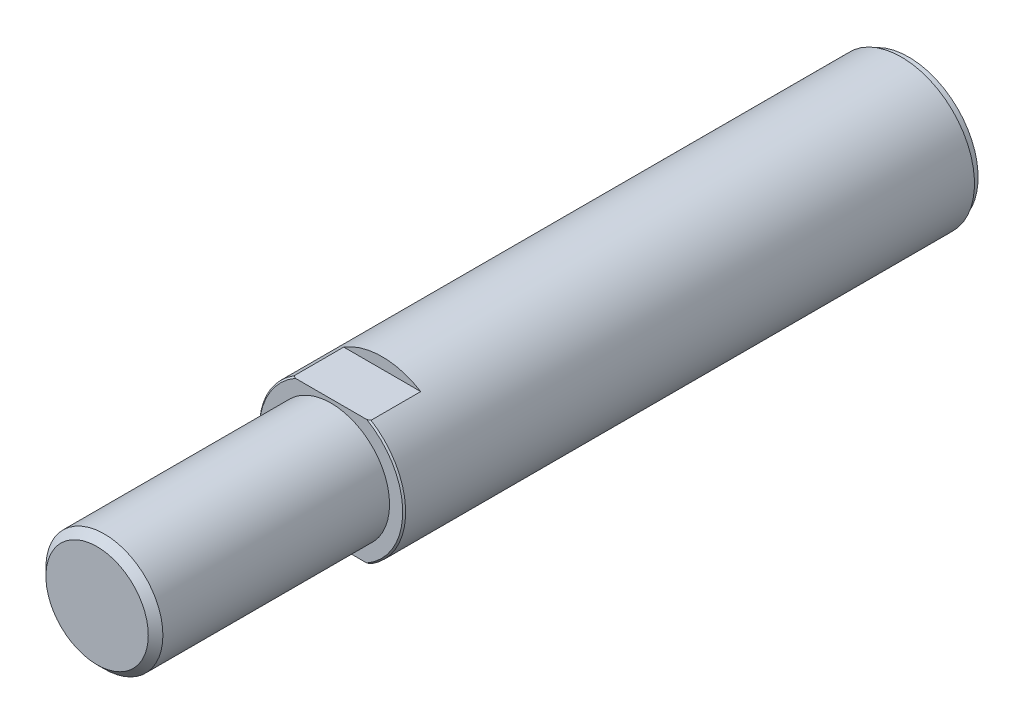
SolidWorks part; units mm, degrees
ref_plane "Plano frontal" through (0, 0, 0) normal (0, 0, 1) x (1, 0, 0)
ref_plane "Plano superior" through (0, 0, 0) normal (0, 1, 0) x (1, 0, 0)
ref_plane "Plano direito" through (0, 0, 0) normal (1, 0, 0) x (0, 0, -1)
sketch "Esboço1" plane through (0, 0, 0) normal (0, 0, 1) x (1, 0, 0)
  circle A0 centre (0, 0) radius 10
  dimension "D1" = 20
extrude "Ressalto-extrusão1" add sketch "Esboço1" along normal blind 111
sketch "Esboço2" plane through (0, 0, 111) normal (0, 0, 1) x (1, 0, 0)
  circle A0 centre (0, 0) radius 8
  dimension "D1" = 16
extrude "Corte-extrusão1" cut sketch "Esboço2" against normal blind 32 flip side to cut
hole_wizard "Furo roscado de M10x1.51" positions "Esboço5" profile "Esboço4" tap size "M10x1.5" standard "Ansi Metric"
sketch "Esboço5" plane through (0, 0, 0) normal (0, 0, -1) x (-1, 0, 0)
  point P0 (0, 0)
sketch "Esboço4" plane through (0, 0, 0) normal (1, 0, 0) x (0, 1, 0)
  line L0 (0, 0) -> (0, 30.0537)
  line L1 (0, 30.0537) -> (4.25, 27.5)
  line L2 (4.25, 27.5) -> (4.25, 0)
  line L5 (4.25, 0) -> (0, 0)
  line L10 (0, 30.0537) -> (-4.25, 27.5) construction
  line L11 (0, -6.35) -> (0, 107.95) construction
  dimension "Tap Drill Dia." = 8.5
  dimension "Tap Drill Depth" = 27.5
  dimension "Drill Angle" = 118
sketch "Esboço6" plane through (0, 0, 0) normal (0, 0, -1) x (-1, 0, 0)
  circle A0 centre (0, 0) radius 9.5
  dimension "D1" = 19
extrude "Corte-extrusão2" cut sketch "Esboço6" against normal blind 1 flip side to cut
chamfer "Chanfro1" distance 1 angle 45 1 edges at (8, 0, 111)
chamfer "Chanfro2" distance 0.2 angle 45 1 edges at (10, 0, 79)
sketch "Esboço7" plane through (0, 0, 79) normal (0, 0, 1) x (1, 0, 0)
  line L1 (-15.7371, -8.5) -> (15.7371, -8.5)
  line L2 (-15.7371, -8.5) -> (-15.7371, 8.5)
  line L3 (-15.7371, 8.5) -> (15.7371, 8.5)
  line L4 (15.7371, -8.5) -> (15.7371, 8.5)
  line L5 (-15.7371, -8.5) -> (15.7371, 8.5) construction
  line L6 (-15.7371, 8.5) -> (15.7371, -8.5) construction
  point P0 (0, 0)
  dimension "D1" = 17
extrude "Corte-extrusão3" cut sketch "Esboço7" against normal blind 7 flip side to cut
